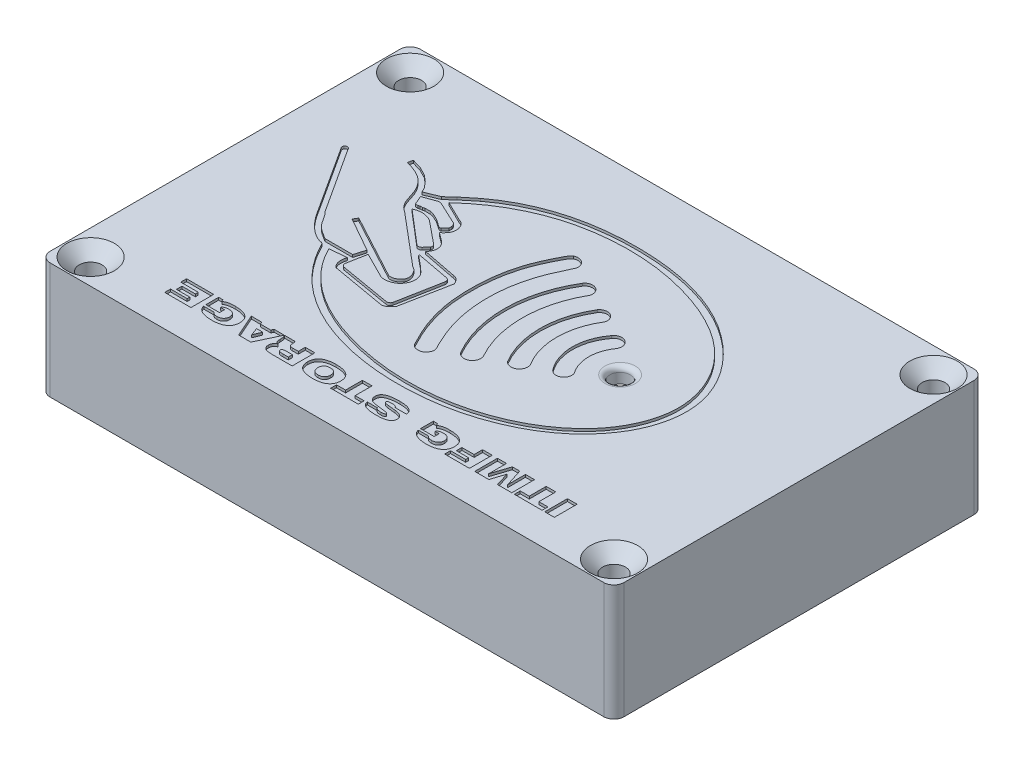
SolidWorks part; units mm, degrees
ref_plane "Front Plane" through (0, 0, 0) normal (0, 0, 1) x (1, 0, 0)
ref_plane "Top Plane" through (0, 0, 0) normal (0, 1, 0) x (1, 0, 0)
ref_plane "Right Plane" through (0, 0, 0) normal (1, 0, 0) x (0, 0, -1)
sketch "Base Outline" plane through (0, 0, 0) normal (0, 1, 0) x (1, 0, 0)
  line L0 (-44.8124, -26.6306) -> (44.728, -26.6306)
  line L1 (-46.8124, -24.6306) -> (-46.8124, 24.5759)
  line L2 (-44.8124, 26.5759) -> (44.728, 26.5759)
  line L3 (46.728, -24.6306) -> (46.728, 24.5759)
  line L9 (-54.8124, -36.6306) -> (54.6981, -36.6306)
  line L10 (-56.8124, -34.6306) -> (-56.8124, 34.5759)
  line L11 (-54.8124, 36.5759) -> (54.6981, 36.5759)
  line L12 (56.6981, -34.6306) -> (56.6981, 34.5759)
  arc A0 (-44.8124, -26.6306) -> (-46.8124, -24.6306) centre (-44.8124, -24.6306) cw
  arc A1 (44.728, -26.6306) -> (46.728, -24.6306) centre (44.728, -24.6306) ccw
  arc A2 (44.728, 26.5759) -> (46.728, 24.5759) centre (44.728, 24.5759) cw
  arc A3 (-46.8124, 24.5759) -> (-44.8124, 26.5759) centre (-44.8124, 24.5759) cw
  arc A4 (54.6981, -36.6306) -> (56.6981, -34.6306) centre (54.6981, -34.6306) ccw
  arc A5 (54.6981, 36.5759) -> (56.6981, 34.5759) centre (54.6981, 34.5759) cw
  arc A6 (-56.8124, 34.5759) -> (-54.8124, 36.5759) centre (-54.8124, 34.5759) cw
  arc A7 (-54.8124, -36.6306) -> (-56.8124, -34.6306) centre (-54.8124, -34.6306) cw
  point P24 (0, 0)
  dimension "D1" = 2
extrude "Extrude Base" add sketch "Base Outline" along normal blind 20
sketch "Lid Outline" plane through (0, 20, 0) normal (0, 1, 0) x (1, 0, 0)
  line L1 (-54.8124, 36.5759) -> (54.6981, 36.5759)
  line L2 (-56.8124, 34.5759) -> (-56.8124, -34.6306)
  line L3 (-54.8124, -36.6306) -> (54.6981, -36.6306)
  line L4 (56.6981, 34.5759) -> (56.6981, -34.6306)
  arc A0 (-56.8124, -34.6306) -> (-54.8124, -36.6306) centre (-54.8124, -34.6306) ccw
  arc A1 (54.6981, -36.6306) -> (56.6981, -34.6306) centre (54.6981, -34.6306) ccw
  arc A2 (54.6981, 36.5759) -> (56.6981, 34.5759) centre (54.6981, 34.5759) cw
  arc A3 (-54.8124, 36.5759) -> (-56.8124, 34.5759) centre (-54.8124, 34.5759) ccw
  dimension "D1" = 2
extrude "Extrude Lid" add sketch "Lid Outline" along normal blind 3
fillet "Smooth Top Edges" [suppressed] radius 2
sketch "LED Hole" plane through (0, 20, 0) normal (0, -1, 0) x (1, 0, 0)
  circle A0 centre (20.728, -0.5759) radius 2
  point P0 (0, 0)
extrude "Cut LED Hole" cut sketch "LED Hole" against normal blind 5 and the other way blind 3
fillet "Smooth LED Hole" radius 1 1 edges at (20.728, 23, 1.4241)
sketch "RDIF Logo" plane through (0, 23, 0) normal (0, 1, 0) x (1, 0, 0)
  line L0 (-35.4426, 247.1071) -> (-835.4426, 247.1071) construction
  line L1 (-187.6479, -336.6792) -> (-987.6479, -336.6792) construction
  line L2 (-74.6044, 332.0339) -> (4.7444, 332.0339) construction
  line L3 (-127.0089, -321.9886) -> (-927.0089, -321.9886) construction
  line L4 (-167.5044, -335.5872) -> (-967.5044, -335.5872) construction
  line L5 (-36.4532, 16.864) -> (-34.5538, 16.3006)
  line L6 (-34.5538, 16.3006) -> (-32.8807, 15.4498)
  line L7 (-32.8807, 15.4498) -> (-31.6045, 14.3722)
  line L8 (-31.6045, 14.3722) -> (-30.5836, 13.1244)
  line L9 (-30.5836, 13.1244) -> (-30.1866, 12.302)
  line L10 (-30.1866, 12.302) -> (-27.4358, 13.4363)
  line L11 (-27.4358, 13.4363) -> (-25.8325, 14.911)
  line L12 (-25.8325, 14.911) -> (-23.2781, 17.001)
  line L13 (-37.4315, -0.9549) -> (-45.6698, 11.7669)
  line L14 (-44.8251, 12.302) -> (-36.4532, -0.5898)
  line L15 (-31.8105, -5.2804) -> (-26.3174, -5.2804)
  line L16 (-26.3174, -5.2804) -> (-25.6697, -3.0972)
  line L17 (-25.6697, -3.0972) -> (-32.4506, 0.7405)
  line L18 (-32.4506, 0.7405) -> (-31.9749, 1.5809)
  line L19 (-31.9749, 1.5809) -> (-19.2197, -5.2804)
  line L20 (-18.3035, -1.4088) -> (-28.5284, 7.2035)
  line L21 (-36.4532, 16.864) -> (-36.7023, 15.8973)
  line L22 (-29.651, -6.6466) -> (-26.3174, -6.3246)
  line L23 (-29.5489, 11.3734) -> (-26.9527, 12.302)
  line L24 (-26.9527, 12.302) -> (-26.4707, 12.302)
  line L25 (-26.4707, 12.302) -> (-21.818, 10.1141)
  line L26 (-21.818, 10.1141) -> (-21.4959, 9.8188)
  line L27 (-21.4959, 9.8188) -> (-21.3339, 9.3658)
  line L28 (-21.3339, 9.3658) -> (-21.3339, 8.8238)
  line L29 (-21.3339, 8.8238) -> (-21.7339, 8.3877)
  line L30 (-21.7339, 8.3877) -> (-22.1315, 7.9542)
  line L31 (-22.1315, 7.9542) -> (-22.4753, 7.9542)
  line L32 (-22.4753, 7.9542) -> (-24.1443, 9.0948)
  line L33 (-24.1443, 9.0948) -> (-25.3016, 9.639)
  line L34 (-25.3016, 9.639) -> (-26.0645, 9.8188)
  line L35 (-26.0645, 9.8188) -> (-27.1392, 9.8188)
  line L36 (-27.1392, 9.8188) -> (-27.4845, 9.6953)
  line L37 (-27.4845, 9.6953) -> (-27.9476, 9.6953)
  line L38 (-27.9476, 9.6953) -> (-28.2508, 9.5868)
  line L39 (-28.2508, 9.5868) -> (-28.7871, 9.5868)
  line L40 (-28.7871, 9.5868) -> (-29.5489, 11.3734)
  line L41 (-25.6697, 13.1244) -> (-21.7339, 11.2099)
  line L42 (-21.4959, 7.0515) -> (-19.8904, 5.8459)
  line L43 (-19.6324, 2.4641) -> (-12.8337, 1.1371)
  line L44 (-25.6697, -9.185) -> (-14.9117, -11.068)
  line L45 (-13.0931, -9.7739) -> (-11.2491, -0.2615)
  line L46 (-28.2508, 8.3877) -> (-21.7339, 2.8334)
  line L47 (-20.7004, 2.8334) -> (-19.8904, 3.7333)
  line L48 (-20.2934, 4.6681) -> (-24.5455, 8.1315)
  line L49 (-19.667, 1.2683) -> (-13.0675, 0.0223)
  line L50 (-12.5095, -0.7954) -> (-14.1436, -9.4508)
  line L51 (-14.949, -10.011) -> (-24.9672, -8.3046)
  line L52 (-25.5375, -7.4847) -> (-24.8238, -3.7041)
  line L53 (-24.8238, -3.7041) -> (-19.6324, -6.3246)
  arc A0 (-45.6698, 11.7669) -> (-44.8251, 12.302) centre (-45.3302, 12.1651) cw
  arc A1 (-21.7339, 2.8334) -> (-20.7004, 2.8334) centre (-21.2171, 3.3421) ccw
  arc A2 (-20.2934, 4.6681) -> (-19.8904, 3.7333) centre (-20.6367, 3.9658) cw
  arc A3 (-24.9672, -8.3046) -> (-25.5375, -7.4847) centre (-24.8497, -7.6145) cw
  arc A4 (-14.1436, -9.4508) -> (-14.949, -10.011) centre (-14.8315, -9.321) cw
  arc A5 (-13.0675, 0.0223) -> (-12.5095, -0.7954) centre (-13.1973, -0.6656) cw
  arc A6 (-4.2252, 16.3006) -> (-1.8634, 14.5908) centre (-3.483, 14.8396) cw
  arc A7 (1.336, 12.5658) -> (4.1222, 11.2099) centre (2.6212, 11.6661) cw
  arc A8 (4.1222, 11.2099) -> (3.9509, -9.6309) centre (22.5346, 0.6374) ccw
  arc A9 (3.9509, -9.6309) -> (1.0734, -11.2548) centre (2.5048, -10.4299) cw
  arc A10 (1.336, 12.5658) -> (1.0734, -11.2548) centre (21.357, 0.4334) ccw
  arc A11 (7.3232, 9.4603) -> (10.1557, 8.1315) centre (8.6268, 8.5557) cw
  arc A12 (10.1557, -6.6466) -> (7.3381, -8.3046) centre (8.6045, -7.2335) cw
  arc A13 (10.1557, 8.1315) -> (10.1557, -6.6466) centre (21.8405, 0.7424) ccw
  arc A14 (7.3381, -8.3046) -> (7.3232, 9.4603) centre (22.0588, 0.5902) cw
  arc A15 (13.1659, 6.4353) -> (15.8945, 4.7467) centre (14.4945, 5.5334) cw
  arc A16 (13.3062, -5.3301) -> (15.8945, -3.6348) centre (14.4789, -4.2971) ccw
  arc A17 (15.8945, 4.7467) -> (15.8945, -3.6348) centre (21.6864, 0.556) ccw
  arc A18 (13.3062, -5.3301) -> (13.1659, 6.4353) centre (20.7568, 0.6423) cw
  spline S0 degree 3 poles (-23.2781, 17.001) (-16.0474, 22.4823) (0.2652, 25.8623) (22.8001, 20.9498) (34.3233, 7.099) (33.2933, -5.2807) (27.3016, -14.707) (14.9217, -21.5905) (-7.1115, -24.8161) (-25.3907, -18.1491) (-31.1109, -6.6466) knots 0 0 0 0 0.175848 0.320222 0.444345 0.487298 0.560216 0.656671 0.759439 1 1 1 1
  spline S1 degree 2 poles (-31.1109, -6.6466) (-31.318, -6.1955) (-31.8105, -6.2597) knots 0 0 0 1 1 1
  spline S2 degree 3 poles (-31.8105, -6.2597) (-34.2999, -5.3977) (-36.1173, -3.1173) (-37.4315, -0.9549) knots 0 0 0 0 1 1 1 1
  spline S3 degree 3 poles (-36.4532, -0.5898) (-35.5369, -1.4447) (-34.7018, -3.7189) (-32.5958, -4.7431) (-31.8105, -5.2804) knots 0 0 0 0 0.56661 1 1 1 1
  spline S4 degree 3 poles (-19.2197, -5.2804) (-18.6968, -5.4617) (-17.7845, -5.1962) (-16.2121, -3.6601) (-17.4598, -1.7171) (-18.3035, -1.4088) knots 0 0 0 0 0.255544 0.46848 1 1 1 1
  spline S5 degree 3 poles (-36.7023, 15.8973) (-35.4596, 15.5728) (-33.0662, 14.8145) (-30.435, 11.2877) (-30.3656, 8.2968) (-28.5284, 7.2035) knots 0 0 0 0 0.313403 0.576876 1 1 1 1
  spline S6 degree 3 poles (-25.6697, 13.1244) (-22.0243, 16.54) (-14.6494, 20.9376) (-1.3564, 23.4439) (13.6104, 21.9827) (28.3907, 14.5203) (33.4773, 0.7946) (29.7823, -9.3779) (20.2561, -17.9887) (6.5039, -22.228) (-12.7341, -20.998) (-25.7628, -14.6972) (-29.651, -6.6466) knots 0 0 0 0 0.101436 0.168774 0.271066 0.404844 0.476586 0.547212 0.609656 0.73226 0.825504 1 1 1 1
  spline S7 degree 3 poles (-21.7339, 11.2099) (-20.9784, 11.0398) (-20.2658, 10.0809) (-20.1926, 8.2818) (-20.9923, 7.4518) (-21.4959, 7.0515) knots 0 0 0 0 0.422834 0.60681 1 1 1 1
  spline S8 degree 3 poles (-19.8904, 5.8459) (-19.4135, 5.5202) (-18.5974, 4.338) (-19.1348, 2.9579) (-19.6324, 2.4641) knots 0 0 0 0 0.454204 1 1 1 1
  spline S9 degree 3 poles (-12.8337, 1.1371) (-12.0548, 1.1078) (-11.4832, 0.4203) (-11.2491, -0.2615) knots 0 0 0 0 1 1 1 1
  spline S10 degree 3 poles (-26.3174, -6.3246) (-26.6285, -7.2932) (-26.6275, -8.4882) (-25.6697, -9.185) knots 0 0 0 0 1 1 1 1
  spline S11 degree 3 poles (-13.0931, -9.7739) (-13.5428, -10.3821) (-14.0282, -11.0545) (-14.9117, -11.068) knots 0 0 0 0 1 1 1 1
  spline S12 degree 3 poles (-28.2508, 8.3877) (-27.1085, 9.0094) (-25.6104, 8.8465) (-24.5455, 8.1315) knots 0 0 0 0 1 1 1 1
  spline S13 degree 3 poles (-19.667, 1.2683) (-19.7041, 1.1192) (-19.5105, 0.9912) (-19.1642, 0.6961) (-18.4136, 0.1072) (-17.281, -0.8523) (-16.0294, -1.9831) (-15.5928, -3.8028) (-16.6177, -6.0657) (-18.6383, -6.5628) (-19.6324, -6.3246) knots 0 0 0 0 0.033061 0.052212 0.119094 0.274788 0.438452 0.533719 0.73725 1 1 1 1
  spline S14 degree 3 poles (-4.2252, 16.3006) (-4.6413, 15.9795) (-5.0484, 15.3045) (-5.9511, 13.5179) (-7.3595, 10.5489) (-8.5343, 6.1192) (-8.9589, 0.7939) (-8.66, -4.7364) (-7.1236, -9.9583) (-5.5497, -13.1518) (-4.634, -14.8972) (-3.7363, -15.2406) (-2.4464, -15.1508) (-1.742, -13.9501) (-1.9304, -13.0752) (-2.2581, -12.5657) (-2.7201, -11.5755) (-3.6091, -9.6196) (-4.9911, -5.8406) (-6.0625, 1.4482) (-4.9693, 7.6789) (-3.2254, 11.5989) (-2.7168, 12.7274) (-2.177, 13.8133) (-1.8634, 14.5908) knots 0 0 0 0 0.023456 0.035576 0.091467 0.173053 0.242957 0.334628 0.424686 0.487211 0.50073 0.510696 0.529229 0.555718 0.559791 0.569748 0.582938 0.60977 0.667724 0.765952 0.943515 0.944708 0.961752 1 1 1 1
  dimension "D1" = 0.7
extrude "Cut logo" cut sketch "RDIF Logo" against normal blind 0.5 contours A6 S14 | A7 A10 A9 A8 | A14 A12 A13 A11 | A18 A16 A17 A15 | L21 S5 L20 S4 L19 L18 L17 L16 L15 S3 L14 A0 L13 S2 S1 S0 L12 L11 L10 L9 L8 L7 L6 L5 S13 L49 A5 L50 A4 L51 A3 L52 L53 S11 L45 S9 L43 S8 L42 S7 L41 S6 L22 S10 L44 L39 L40 L23
sketch "Text line" plane through (0, 23, 0) normal (0, 1, 0) x (1, 0, 0)
  line L0 (39.1661, -25.8557) -> (-38.1268, -25.8557)
  point P2 (39.1661, -25.7276)
  point P3 (-38.1268, -25.8557)
sketch "Text" plane through (0, 23, 0) normal (0, 1, 0) x (1, 0, 0)
  text T0 "ITMFG STORAGE" font "Swis721 BlkEx BT" height 4.5
extrude "Cut-Extrude1" cut sketch "Text" against normal blind 0.5
sketch "Screw Locations" plane through (0, 23, 0) normal (0, 1, 0) x (1, 0, 0)
  circle A0 centre (51.728, -31.6306) radius 4.5
  circle A1 centre (-51.8124, -31.6306) radius 4.5
  circle A2 centre (-51.8124, 31.5759) radius 4.5
  circle A3 centre (51.728, 31.5759) radius 4.5
  point P12 (0, 0)
  point P13 (0, 0)
  point P14 (0, 0)
  point P15 (0, 0)
hole_wizard "Cut the screw holes nicely" positions "3DSketch2" profile "Sketch9" countersink size "M4" standard "ANSI Metric"
sketch3d "3DSketch2"
  point P0 (51.728, 23, 31.6306)
  point P3 (-51.8124, 23, 31.6306)
  point P6 (-51.8124, 23, -31.5759)
  point P9 (51.728, 23, -31.5759)
sketch "Sketch9" plane through (51.728, 23, 31.6306) normal (1, 0, 0) x (0, 0, 1)
  line L0 (0, 0) -> (0, 23)
  line L1 (0, 23) -> (2.25, 23)
  line L2 (2.25, 23) -> (2.25, 2.45)
  line L3 (2.25, 2.45) -> (4.7, 0)
  line L5 (4.7, 0) -> (0, 0)
  line L6 (-2.25, 2.45) -> (-4.7, 0) construction
  line L11 (0, -6.35) -> (0, 107.95) construction
  dimension "Thru Hole Dia." = 4.5
  dimension "Thru Hole Depth" = 23
  dimension "Near C'Sink Dia." = 9.4
  dimension "Near C'Sink Angle" = 90
